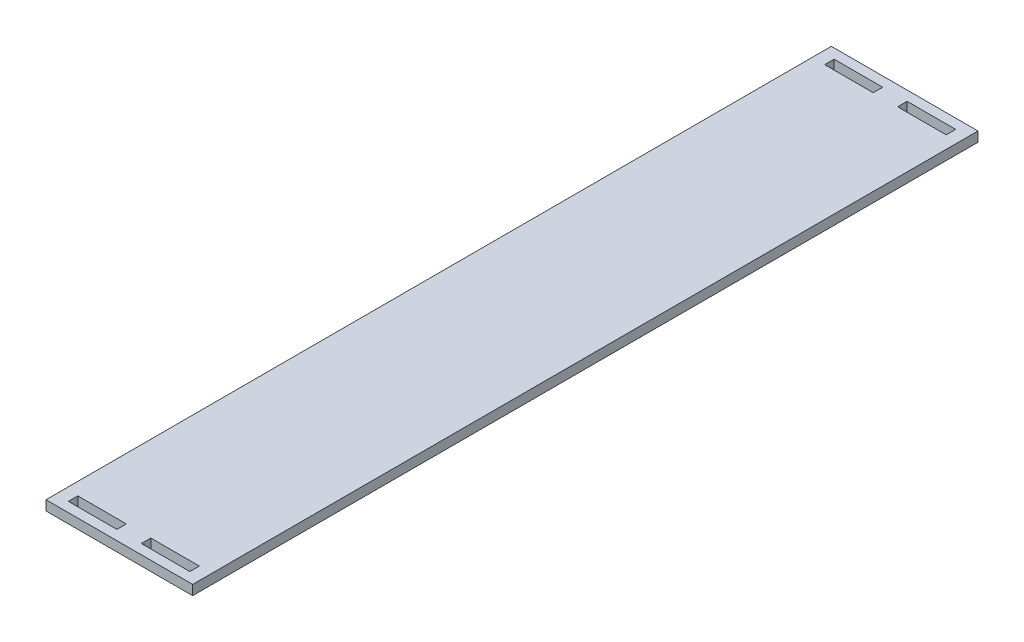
SolidWorks part; units mm, degrees
ref_plane "Alzado" through (0, 0, 0) normal (0, 0, 1) x (1, 0, 0)
ref_plane "Planta" through (0, 0, 0) normal (0, 1, 0) x (1, 0, 0)
ref_plane "Vista lateral" through (0, 0, 0) normal (1, 0, 0) x (0, 0, -1)
sketch "Croquis1" plane through (0, 0, 0) normal (0, 1, 0) x (1, 0, 0)
  line L0 (0, 0) -> (0, 6) construction
  line L1 (0, 0) -> (90, 0)
  line L2 (0, 0) -> (0, 482)
  line L3 (0, 482) -> (90, 482)
  line L4 (90, 0) -> (90, 482)
  line L5 (0, 6) -> (7.7, 6) construction
  line L6 (37.5, 6) -> (52.5, 6) construction
  line L7 (7.7, 6) -> (37.5, 6)
  line L8 (7.7, 6) -> (7.7, 11.8)
  line L9 (7.7, 11.8) -> (37.5, 11.8)
  line L10 (37.5, 6) -> (37.5, 11.8)
  line L11 (45, 0) -> (45, 482) construction
  line L12 (82.3, 6) -> (52.5, 6)
  line L13 (52.5, 6) -> (52.5, 11.8)
  line L14 (82.3, 6) -> (82.3, 11.8)
  line L15 (82.3, 11.8) -> (52.5, 11.8)
  line L16 (0, 241) -> (90, 241) construction
  line L17 (82.3, 476) -> (82.3, 470.2)
  line L18 (82.3, 476) -> (52.5, 476)
  line L19 (82.3, 470.2) -> (52.5, 470.2)
  line L20 (52.5, 476) -> (52.5, 470.2)
  line L21 (37.5, 476) -> (37.5, 470.2)
  line L22 (7.7, 476) -> (37.5, 476)
  line L23 (7.7, 476) -> (7.7, 470.2)
  line L24 (7.7, 470.2) -> (37.5, 470.2)
  dimension "D1" = 482
  dimension "D2" = 90
  dimension "D3" = 6
  dimension "D4" = 7.7
  dimension "D5" = 29.8
  dimension "D6" = 5.8
extrude "Saliente-Extruir1" add sketch "Croquis1" along normal blind 6
